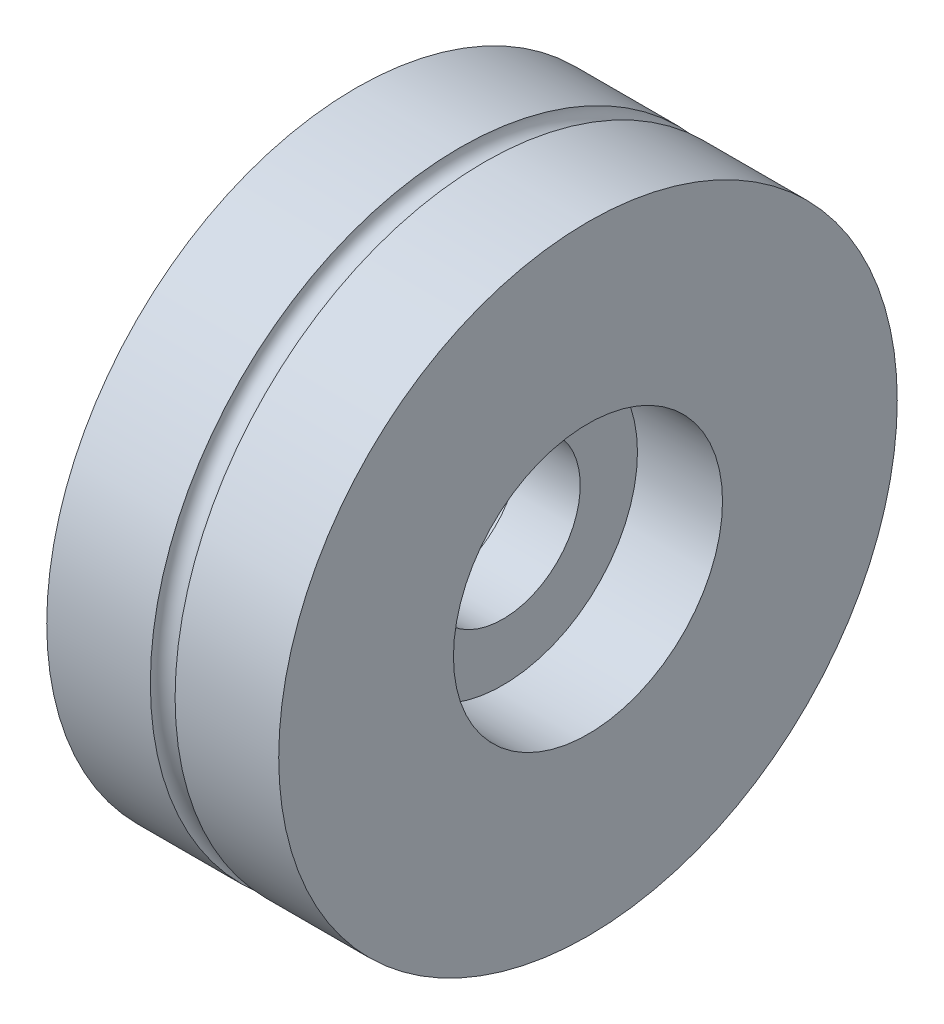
SolidWorks part; units mm, degrees
ref_plane "Front Plane" through (0, 0, 0) normal (0, 0, 1) x (1, 0, 0)
ref_plane "Top Plane" through (0, 0, 0) normal (0, 1, 0) x (1, 0, 0)
ref_plane "Right Plane" through (0, 0, 0) normal (1, 0, 0) x (0, 0, -1)
sketch "Sketch1" plane through (0, 0, 0) normal (0, 0, 1) x (1, 0, 0)
  line L0 (-2.54, 6.35) -> (2.54, 6.35)
  line L1 (2.54, 6.35) -> (2.54, 11.049)
  line L2 (2.54, 11.049) -> (9.525, 11.049)
  line L3 (9.525, 11.049) -> (9.525, 25.4)
  line L4 (9.525, 25.4) -> (1.016, 25.4)
  line L6 (0, 25.4) -> (0, 0) construction
  line L7 (-9.525, 25.4) -> (-1.016, 25.4)
  line L9 (-9.525, 11.049) -> (-9.525, 25.4)
  line L10 (-2.54, 11.049) -> (-9.525, 11.049)
  line L11 (-2.54, 6.35) -> (-2.54, 11.049)
  line L12 (-6.0299, 0) -> (6.0299, 0) construction
  arc A0 (-1.016, 25.4) -> (1.016, 25.4) centre (0, 25.4) ccw
  point P15 (0, 6.35)
  dimension "D8" = 2.032
  dimension "D1" = 12.7
  dimension "D2" = 22.098
  dimension "D3" = 6.985
  dimension "D4" = 19.05
  dimension "D5" = 50.8
revolve "Revolve1" add sketch "Sketch1" angle 360 about L12
